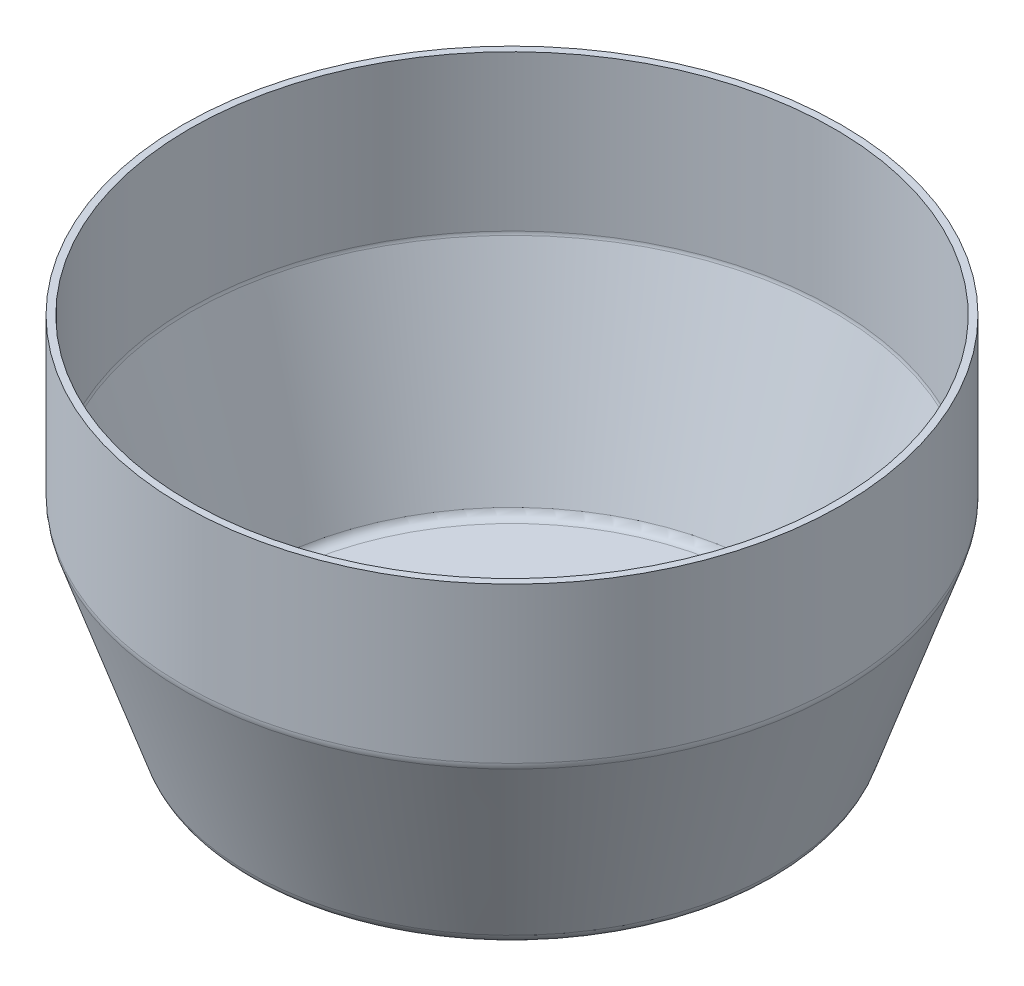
SolidWorks part; units mm, degrees
ref_plane "Plan de face" through (0, 0, 0) normal (0, 0, 1) x (1, 0, 0)
ref_plane "Plan de dessus" through (0, 0, 0) normal (0, 1, 0) x (1, 0, 0)
ref_plane "Plan de droite" through (0, 0, 0) normal (1, 0, 0) x (0, 0, -1)
sketch "Esquisse1" plane through (0, 0, 0) normal (0, 0, 1) x (1, 0, 0)
  line L0 (0, 38.3986) -> (0, -132.5045) construction
  line L1 (-93.5, 0) -> (-93.5, -45)
  line L2 (-93.3389, -45.9698) -> (-74.5511, -100.9698)
  line L3 (-95.5, 0) -> (-95.5, -45)
  line L4 (-95.2316, -46.6163) -> (-76.4437, -101.6163)
  line L5 (-71.7122, -105) -> (0, -105)
  line L6 (-95.5, -45) -> (-95.5, -85.4744) construction
  line L7 (-71.7122, -103) -> (0, -103)
  line L8 (-95.5, 0) -> (-93.5, 0)
  line L9 (0, -103) -> (0, -105)
  arc A0 (-95.2316, -46.6163) -> (-95.5, -45) centre (-90.5, -45) cw
  arc A1 (-76.4437, -101.6163) -> (-71.7122, -105) centre (-71.7122, -100) ccw
  arc A2 (-93.3389, -45.9698) -> (-93.5, -45) centre (-90.5, -45) cw
  arc A3 (-74.5511, -100.9698) -> (-71.7122, -103) centre (-71.7122, -100) ccw
  dimension "D4" = 5
  dimension "D5" = 5
  dimension "D1" = 2
  dimension "D2" = 95.5
  dimension "D3" = 105
  dimension "D6" = 60
  dimension "D9" = 18.86
revolve "Révolution3" add sketch "Esquisse1" angle 360 about L0
sketch "Esquisse2" plane through (0, -103, 0) normal (0, 1, 0) x (-1, 0, 0)
  circle A0 centre (0, 0) radius 30.25
  dimension "D1" = 60.5
extrude "Enlèv. mat.-Extru.3" cut sketch "Esquisse2" against normal through all
sketch "Esquisse4" plane through (0, -103, 0) normal (0, 1, 0) x (1, 0, 0)
  line L0 (0, 0) -> (-66.9557, 0) construction
  circle A0 centre (-42, 0) radius 2.75
  dimension "D1" = 5.5
  dimension "D2" = 42
extrude "Trou débouchant de 6.5" cut sketch "Esquisse4" against normal through all
pattern_circular "Répétition circulaire1" count 6 every 60 about axis through (0, 0, 0) along (0, 1, 0) of "Trou débouchant de 6.5"
sketch "Esquisse5" plane through (0, -103, 0) normal (0, 1, 0) x (1, 0, 0)
  line L1 (0, 0) -> (-111.9844, 0) construction
  circle A0 centre (-60, 0) radius 8
  dimension "D1" = 16
  dimension "D2" = 60
extrude "Enlèv. mat.-Extru.6" cut sketch "Esquisse5" against normal through all
